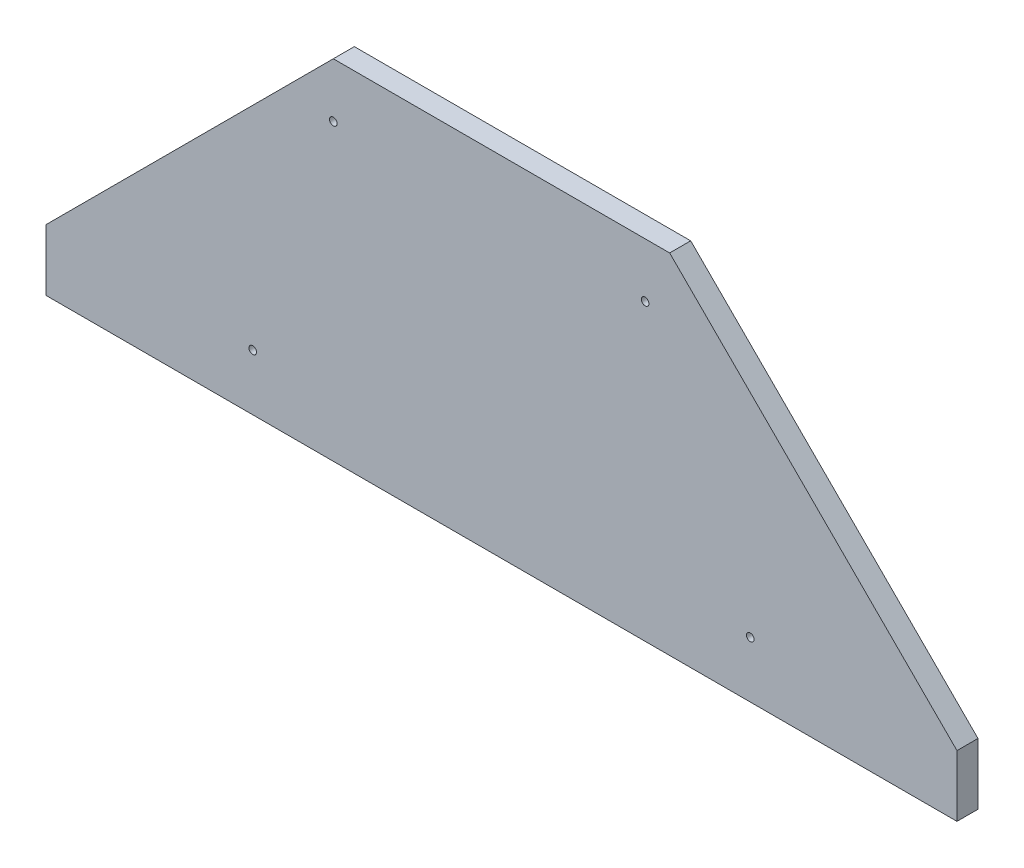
SolidWorks part; units mm, degrees
ref_plane "Front Plane" through (0, 0, 0) normal (0, 0, 1) x (1, 0, 0)
ref_plane "Top Plane" through (0, 0, 0) normal (0, 1, 0) x (1, 0, 0)
ref_plane "Right Plane" through (0, 0, 0) normal (1, 0, 0) x (0, 0, -1)
sketch "Sketch1" plane through (0, 0, 0) normal (0, 0, 1) x (1, 0, 0)
  line L0 (152.4, 157.9562) -> (412.75, -102.3937)
  line L1 (-412.75, -157.9562) -> (412.75, -157.9562)
  line L2 (-412.75, -157.9562) -> (-412.75, 157.9562)
  line L3 (-412.75, 157.9562) -> (412.75, 157.9562)
  line L4 (412.75, -157.9562) -> (412.75, 157.9562)
  line L5 (-412.75, -157.9562) -> (412.75, 157.9562) construction
  line L6 (-412.75, 157.9562) -> (412.75, -157.9562) construction
  line L7 (-152.4, 157.9562) -> (-412.75, -102.3937)
  line L8 (-179.5524, 108.7438) -> (175.2, 108.7438) construction
  line L9 (-289.8776, -107.1562) -> (301.6935, -107.1562) construction
  circle A0 centre (130.175, 108.7438) radius 3.429
  circle A1 centre (-152.4, 108.7438) radius 3.429
  circle A2 centre (-225.425, -107.1562) radius 3.429
  circle A3 centre (225.425, -107.1562) radius 3.429
  point P0 (0, 0)
  dimension "D9" = 6.858
  dimension "D10" = 282.575
  dimension "D11" = 187.325
  dimension "D12" = 638.175
  dimension "D13" = 565.15
  dimension "D1" = 315.9125
  dimension "D2" = 825.5
  dimension "D3" = 260.35
  dimension "D4" = 55.5625
  dimension "D5" = 565.15
  dimension "D6" = 55.5625
  dimension "D7" = 50.8
  dimension "D8" = 266.7
extrude "Extrude1" add sketch "Sketch1" along normal mid plane 19.05 contours L3 L7 L2 L1 L4 L0 A3 A2 A1 A0
